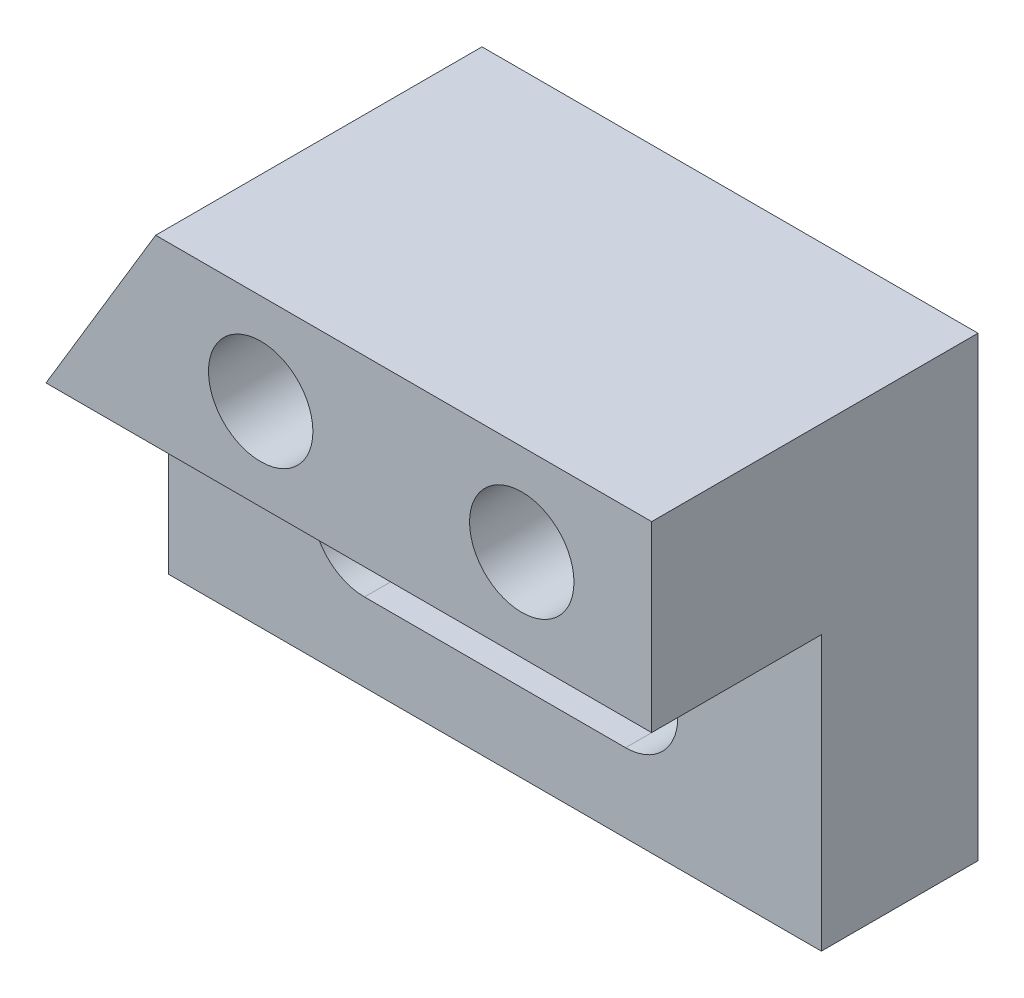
SolidWorks part; units mm, degrees
ref_plane "前视基准面" through (0, 0, 0) normal (0, 0, 1) x (1, 0, 0)
ref_plane "上视基准面" through (0, 0, 0) normal (0, 1, 0) x (1, 0, 0)
ref_plane "右视基准面" through (0, 0, 0) normal (1, 0, 0) x (0, 0, -1)
other "Configuration Table"
sketch "草图2" plane through (0, 0, 0) normal (0, 0, 1) x (1, 0, 0)
  line L0 (0, 0) -> (50, 0)
  line L1 (50, 0) -> (50, 15)
  line L3 (0, 15) -> (0, 0)
  line L6 (12, 35) -> (0, 15)
  line L7 (12, 35) -> (50, 35)
  line L8 (50, 35) -> (50, 15)
extrude "凸台-拉伸1" add sketch "草图2" along normal blind 12
sketch "草图7" plane through (0, 0, 0) normal (0, 0, -1) x (-1, 0, 0)
  line L0 (-50, 35) -> (-50, 21)
  line L1 (-50, 0) -> (-50, 35) construction
  line L2 (-50, 21) -> (-3.6, 21)
  line L3 (-12, 35) -> (0, 15) construction
  line L4 (-3.6, 21) -> (-12, 35)
  line L5 (-12, 35) -> (-50, 35)
extrude "凸台-拉伸3" add sketch "草图7" against normal blind 25
sketch "草图8" plane through (0, 0, 25) normal (0, 0, 1) x (1, 0, 0)
  circle A0 centre (40.0469, 28) radius 4
  circle A1 centre (20.0469, 28) radius 4
extrude "切除-拉伸1" cut sketch "草图8" against normal through all and the other way through all
sketch "草图9" plane through (0, 0, 12) normal (0, 0, 1) x (1, 0, 0)
  line L3 (35, 6) -> (15, 6)
  line L5 (15, 14) -> (35, 14)
  arc A0 (35, 6) -> (35, 14) centre (35, 10) ccw
  arc A1 (15, 6) -> (15, 14) centre (15, 10) cw
extrude "切除-拉伸2" cut sketch "草图9" against normal through all
